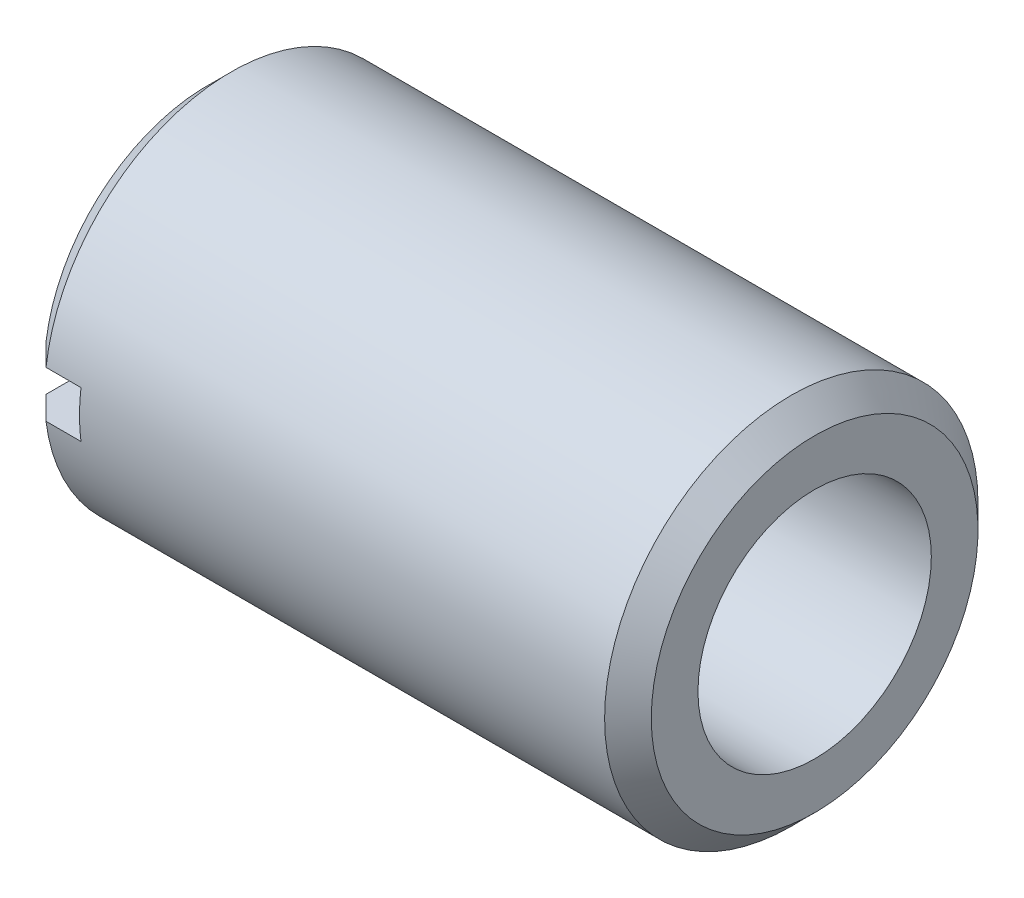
SolidWorks part; units mm, degrees
ref_plane "Face" through (0, 0, 0) normal (0, 0, 1) x (1, 0, 0)
ref_plane "Dessus" through (0, 0, 0) normal (0, 1, 0) x (1, 0, 0)
ref_plane "Droite" through (0, 0, 0) normal (1, 0, 0) x (0, 0, -1)
sketch "Esquisse1" plane through (0, 0, 0) normal (0, 0, 1) x (1, 0, 0)
  line L0 (0, 0) -> (34.8779, 0) construction
  line L1 (0, 0) -> (0, 8)
  line L2 (0, 8) -> (26, 8)
  line L3 (26, 8) -> (26, 5)
  line L4 (26, 5) -> (4, 5)
  line L5 (4, 5) -> (4, 0)
  line L6 (4, 0) -> (0, 0)
  dimension "D1" = 5
  dimension "D2" = 8
  dimension "D3" = 26
  dimension "D4" = 22
revolve "Base-Révolution" add sketch "Esquisse1" angle 360 about L0
sketch "Esquisse2" plane through (0, 0, 0) normal (-1, 0, 0) x (0, 0, 1)
  line L1 (-10.2825, -1) -> (12.1986, -1)
  line L2 (-10.2825, -1) -> (-10.2825, 1)
  line L3 (-10.2825, 1) -> (12.1986, 1)
  line L4 (12.1986, -1) -> (12.1986, 1)
  circle A0 centre (0, 0) radius 8 construction
  dimension "D1" = 2
  dimension "D2" = 1
extrude "Enlèv. mat.-Extru.1" cut sketch "Esquisse2" against normal blind 2.5
chamfer "Chanfrein1" distance 1 angle 45
